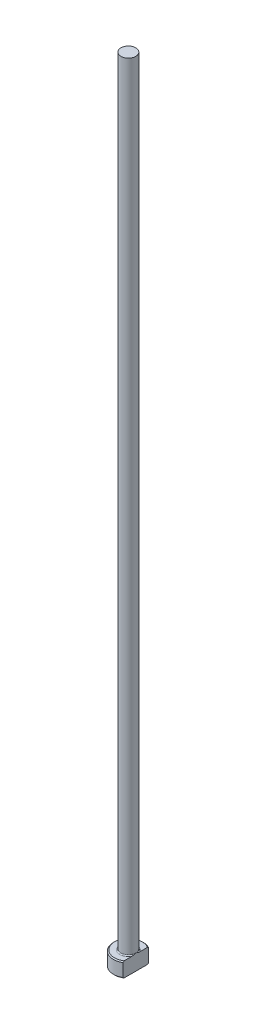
SolidWorks part; units mm, degrees
ref_plane "Front Plane" through (0, 0, 0) normal (0, 0, 1) x (1, 0, 0)
ref_plane "Top Plane" through (0, 0, 0) normal (0, 1, 0) x (1, 0, 0)
ref_plane "Right Plane" through (0, 0, 0) normal (1, 0, 0) x (0, 0, -1)
sketch "Sketch1" plane through (0, 0, 0) normal (0, 0, 1) x (1, 0, 0)
  line L0 (0, 259.9588) -> (0, -15.1925) construction
  line L1 (0, 0) -> (-3, 0)
  line L2 (-3, 0) -> (-3, 3)
  line L3 (-3, 3) -> (-1.5, 3)
  line L4 (-1.5, 3) -> (-1.5, 160)
  line L5 (-1.5, 160) -> (0, 160)
  line L6 (0, 160) -> (0, 0)
  dimension "L" = 160
  dimension "H" = 6
  dimension "T" = 3
  dimension "D" = 3
revolve "Revolve1" add sketch "Sketch1" angle 360 about L0
chamfer "Chamfer1" distance 0.2 angle 45 2 edges at (0, 3, 3) (0, 0, 3)
fillet "Fillet1" radius 0.2 1 edges at (0, 3, 1.5)
sketch "Sketch2" plane through (0, 0, 0) normal (0, 1, 0) x (1, 0, 0)
  line L0 (1.5, 2.5981) -> (1.5, -2.5981)
  circle A0 centre (0, 0) radius 3 construction
  arc A1 (1.5, -2.5981) -> (1.5, 2.5981) centre (0, 0) ccw
  circle A2 centre (0, 0) radius 1.5 construction
extrude "KEY" cut sketch "Sketch2" along normal through all
